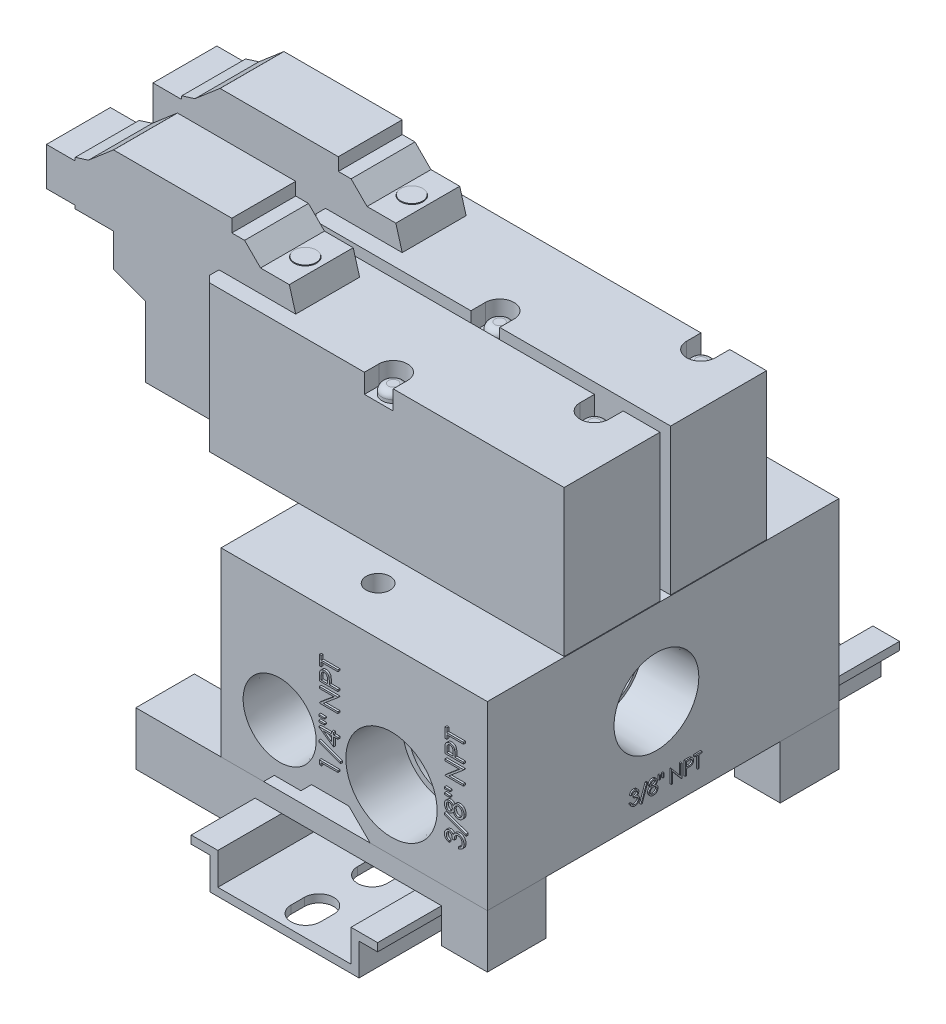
SolidWorks part; units mm, degrees
ref_plane "Front Plane" through (0, 0, 0) normal (0, 0, 1) x (1, 0, 0)
ref_plane "Top Plane" through (0, 0, 0) normal (0, 1, 0) x (1, 0, 0)
ref_plane "Right Plane" through (0, 0, 0) normal (1, 0, 0) x (0, 0, -1)
imported_body "VV3QZ35-0202TC-D_VV3QZ1929manifold-1-solid1"
imported_body "VV3QZ35-0202TC-D_VV5Q Fittings-1-solid1"
imported_body "VV3QZ35-0202TC-D_VQ1000-10A-1-60-1-solid1"
imported_body "VV3QZ35-0202TC-D_VQ1000-10A-1-60-2-solid1"
imported_body "VV3QZ35-0202TC-D_AXT100-DR-1-solid1"
imported_body "VV3QZ35-0202TC-D_VV5Q Fittings-2-solid1"
imported_body "VQZ235-5LO-1/VQZ235-5LO_VQZ1929VALVEBODY-1-solid1"
imported_body "VQZ235-5LO-1/VQZ235-5LO_man_op-PL-1-solid1"
imported_body "VQZ235-5LO-1/VQZ235-5LO_VQZCOIL-1-solid1"
imported_body "VQZ235-5LO-2/VQZ235-5LO_VQZ1929VALVEBODY-1-solid1"
imported_body "VQZ235-5LO-2/VQZ235-5LO_man_op-PL-1-solid1"
imported_body "VQZ235-5LO-2/VQZ235-5LO_VQZCOIL-1-solid1"
sketch "Sketch1" plane through (0, 0, -66) normal (0, 0, -1) x (-1, 0, 0)
  circle A0 centre (-32, 11.5) radius 7.25 construction
  circle A1 centre (-32, 11.5) radius 7.25
extrude "Extrude1" add sketch "Sketch1" against normal up to vertex
sketch "Sketch2" plane through (0, 0, 0) normal (0, 0, 1) x (1, 0, 0)
  circle A0 centre (32, 11.5) radius 7.25 construction
  circle A1 centre (32, 11.5) radius 7.25
hole_wizard "3/8 NPT Tapped Hole1" positions "3DSketch1" profile "Sketch3" size "3/8" standard "Ansi Inch"
sketch3d "3DSketch1"
  point P0 (32, 11.5, -66)
sketch "Sketch3" plane through (32, 11.5, -66) normal (1, 0, 0) x (0, 1, 0)
  line L0 (0, 0) -> (0, 21.6673)
  line L1 (7.1374, 17.3787) -> (0, 21.6673)
  line L2 (-7.1374, 17.3787) -> (0, 21.6673) construction
  line L3 (7.1374, 17.3787) -> (7.1374, 10.3302)
  line L4 (7.1374, 10.3302) -> (8.2632, 10.3302)
  line L5 (8.2632, 10.3302) -> (8.5725, 0)
  line L6 (-8.2632, 10.3302) -> (-8.5725, 0) construction
  line L7 (8.5725, 0) -> (0, 0)
  line L8 (0, -6.35) -> (0, 107.95) construction
  line L11 (-7.1374, 10.3302) -> (-8.2632, 10.3302) construction
  dimension "Tap Drill Dia." = 14.2748
  dimension "Tap Drill Depth" = 17.3787
  dimension "Thread Dia." = 17.145
  dimension "Thread Angle" = 3.43
  dimension "Thread Depth" = 10.3302
  dimension "Drill Angle" = 118
hole_wizard "3/8 NPT Tapped Hole2" positions "3DSketch2" profile "Sketch4" size "3/8" standard "Ansi Inch"
sketch3d "3DSketch2"
  point P0 (32, 11.5, 0)
sketch "Sketch4" plane through (32, 11.5, 0) normal (1, 0, 0) x (0, -1, 0)
  line L0 (0, 0) -> (0, 21.6673)
  line L1 (7.1374, 17.3787) -> (0, 21.6673)
  line L2 (-7.1374, 17.3787) -> (0, 21.6673) construction
  line L3 (7.1374, 17.3787) -> (7.1374, 10.3302)
  line L4 (7.1374, 10.3302) -> (8.2632, 10.3302)
  line L5 (8.2632, 10.3302) -> (8.5725, 0)
  line L6 (-8.2632, 10.3302) -> (-8.5725, 0) construction
  line L7 (8.5725, 0) -> (0, 0)
  line L8 (0, -6.35) -> (0, 107.95) construction
  line L11 (-7.1374, 10.3302) -> (-8.2632, 10.3302) construction
  dimension "Tap Drill Dia." = 14.2748
  dimension "Tap Drill Depth" = 17.3787
  dimension "Thread Dia." = 17.145
  dimension "Thread Angle" = 3.43
  dimension "Thread Depth" = 10.3302
  dimension "Drill Angle" = 118
sketch "Sketch5" plane through (0, 0, -66) normal (0, 0, -1) x (-1, 0, 0)
  circle A0 centre (-11, 11.5) radius 5.5 construction
  circle A1 centre (-11, 11.5) radius 5.5
extrude "Extrude2" add sketch "Sketch5" against normal up to vertex
sketch "Sketch6" plane through (0, 0, 0) normal (0, 0, 1) x (1, 0, 0)
  circle A0 centre (11, 11.5) radius 5.5 construction
  circle A1 centre (11, 11.5) radius 5.5
hole_wizard "1/4 NPT Tapped Hole1" positions "3DSketch3" profile "Sketch7" size "1/4" standard "Ansi Inch"
sketch3d "3DSketch3"
  point P0 (11, 11.5, -66)
  point P3 (11, 11.5, 0)
sketch "Sketch7" plane through (11, 11.5, -66) normal (1, 0, 0) x (0, 1, 0)
  line L0 (0, 0) -> (0, 20.4111)
  line L1 (5.5626, 17.0688) -> (0, 20.4111)
  line L2 (-5.5626, 17.0688) -> (0, 20.4111) construction
  line L3 (5.5626, 17.0688) -> (5.5626, 10.0203)
  line L4 (5.5626, 10.0203) -> (6.546, 10.0203)
  line L5 (6.546, 10.0203) -> (6.858, 0)
  line L6 (-6.546, 10.0203) -> (-6.858, 0) construction
  line L7 (6.858, 0) -> (0, 0)
  line L8 (0, -6.35) -> (0, 107.95) construction
  line L11 (-5.5626, 10.0203) -> (-6.546, 10.0203) construction
  dimension "Tap Drill Dia." = 11.1252
  dimension "Tap Drill Depth" = 17.0688
  dimension "Thread Dia." = 13.716
  dimension "Thread Angle" = 3.567
  dimension "Thread Depth" = 10.0203
  dimension "Drill Angle" = 118
sketch "Sketch8" plane through (0, 0, -66) normal (0, 0, -1) x (-1, 0, 0)
  line L0 (-46.1702, 24.2822) -> (-46.1702, 4.2333) construction
  line L1 (-22.2968, 24.2822) -> (-22.2968, 6.9814) construction
  text T0 "3/8\" NPT"
  text T1 "1/4\" NPT"
extrude "Extrude3" add sketch "Sketch8" along normal blind 0.381
sketch "Sketch9" plane through (0, 0, 0) normal (0, 0, 1) x (1, 0, 0)
  line L0 (45.9073, 7.6094) -> (45.9073, 28.5436) construction
  line L1 (22.3243, 7.6094) -> (22.3243, 26.6165) construction
  text T0 "3/8\" NPT"
  text T1 "1/4\" NPT"
extrude "Extrude4" add sketch "Sketch9" along normal blind 0.381
other "DeleteFace2"
hole_wizard "3/8 NPT Tapped Hole4" positions "Sketch12" profile "Sketch11" size "3/8" standard "Ansi Inch"
sketch "Sketch12" plane through (50, 0, 0) normal (1, 0, 0) x (0, 0, -1)
  line L4 (66, 34) -> (0, 34) construction
  line L7 (0, 0) -> (0, 34) construction
  point P0 (31.75, 18.125)
  dimension "D1" = 15.875
  dimension "D2" = 31.75
sketch "Sketch11" plane through (50, 18.125, -31.75) normal (0, 1, 0) x (0, 0, -1)
  line L0 (0, 0) -> (0, 21.6673)
  line L1 (7.1374, 17.3787) -> (0, 21.6673)
  line L2 (-7.1374, 17.3787) -> (0, 21.6673) construction
  line L3 (7.1374, 17.3787) -> (7.1374, 10.3302)
  line L4 (7.1374, 10.3302) -> (7.6537, 10.3302)
  line L5 (7.6537, 10.3302) -> (7.963, 0)
  line L6 (-7.6537, 10.3302) -> (-7.963, 0) construction
  line L7 (7.963, 0) -> (0, 0)
  line L8 (0, -6.35) -> (0, 107.95) construction
  line L11 (-7.1374, 10.3302) -> (-7.6537, 10.3302) construction
  dimension "Tap Drill Dia." = 14.2748
  dimension "Tap Drill Depth" = 17.3787
  dimension "Thread Dia." = 15.9261
  dimension "Thread Angle" = 3.43
  dimension "Thread Depth" = 10.3302
  dimension "Drill Angle" = 118
sketch "Sketch13" plane through (50, 0, 0) normal (1, 0, 0) x (0, 0, -1)
  line L1 (26.4957, 3.489) -> (39.5593, 3.489) construction
  text T1 "3/8\" NPT" font "Century Gothic" height 2.54
extrude "Extrude5" add sketch "Sketch13" along normal blind 0.254
combine bodies "Combine2" operation type add bodies to combine 109 108 107
scale "Scale1" bodies to scale 125 scale about centroid uniform scaling yes scale factor 1.2
move or copy body "Body-Move/Copy1" bodies to move or copy 126 placed by mates yes
other "Distance1" parameters "D1"=13.5831
delete or keep bodies "Body-Delete2" type delete bodies bodies 110 111 112
pattern_linear "LPattern3" count 2 spacing 20 along (0, 0, 1)
